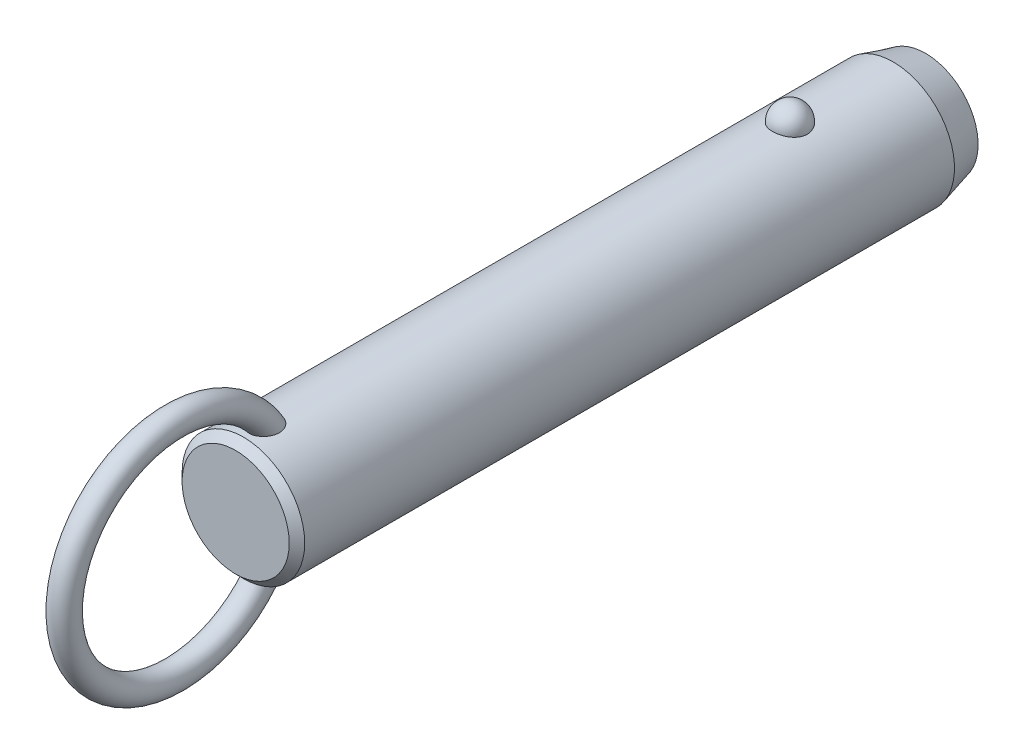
SolidWorks part; units mm, degrees
ref_plane "Front Plane" through (0, 0, 0) normal (0, 0, 1) x (1, 0, 0)
ref_plane "Top Plane" through (0, 0, 0) normal (0, 1, 0) x (1, 0, 0)
ref_plane "Right Plane" through (0, 0, 0) normal (1, 0, 0) x (0, 0, -1)
sketch "Sketch2" plane through (0, 0, 0) normal (0, 0, 1) x (1, 0, 0)
  circle A0 centre (0, 0) radius 9.5
  point P3 (0, 9.5)
  dimension "D1" = 19
extrude "Boss-Extrude1" add sketch "Sketch2" along normal blind 73.7
sketch "Sketch3" plane through (0, 0, 0) normal (0, 0, -1) x (-1, 0, 0)
  circle A0 centre (0, 0) radius 9.5
  dimension "D1" = 19
extrude "Boss-Extrude2" add sketch "Sketch3" along normal blind 23.7
chamfer "Chamfer1" distance 5 angle 15 1 edges at (-9.5, 0, -23.7)
sketch "Sketch12" plane through (0, 0, 0) normal (1, 0, 0) x (0, 0, -1)
  line L0 (-73.7, 9.5) -> (-73.7, -9.5) construction
  point P0 (-73.7, 0)
sketch "Sketch13" plane through (0, 0, 0) normal (1, 0, 0) x (0, 0, -1)
  circle A0 centre (-92.75, 0) radius 19.05
  point P2 (-73.7, 0)
  dimension "D1" = 38.1
sketch "Sketch14" plane through (0, 0, 0) normal (0, 1, 0) x (1, 0, 0)
  circle A0 centre (0, -75.7) radius 2
  point P2 (0, -73.7)
  dimension "D1" = 4
sweep "Sweep1" add profiles "Sketch14" path "Sketch13"
sketch "Sketch15" plane through (0, 0, 73.7) normal (0, 0, 1) x (1, 0, 0)
  circle A0 centre (0, 0) radius 9.5
  dimension "D1" = 19
extrude "Boss-Extrude3" add sketch "Sketch15" along normal blind 9.52
chamfer "Chamfer2" distance 1.2 angle 45 1 edges at (9.5, 0, 83.22)
sketch "Sketch18" plane through (0, 0, 0) normal (1, 0, 0) x (0, 0, -1)
  line L0 (18.7, 9.5) -> (-76.2378, 9.5) construction
  line L1 (2.7, 12.2) -> (2.7, 6.8)
  line L2 (-76.2378, -9.5) -> (18.7, -9.5) construction
  arc A0 (2.7, 12.2) -> (2.7, 6.8) centre (2.7, 9.5) ccw
  point P4 (0, 9.5)
  dimension "D1" = 21.7
revolve "Revolve1" add sketch "Sketch18" angle 360 about L1
